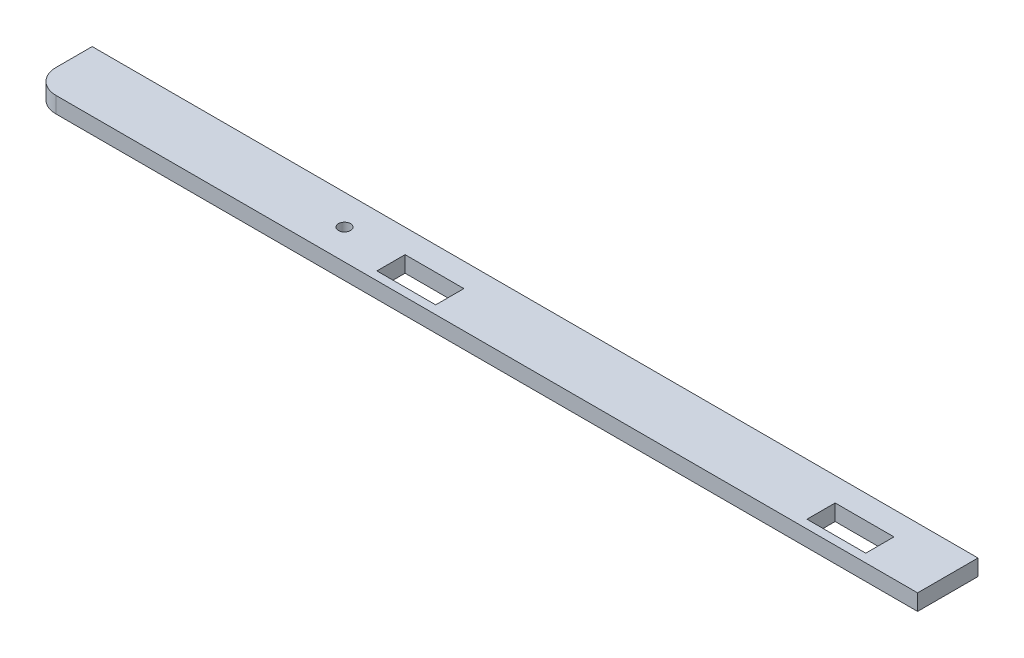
SolidWorks part; units mm, degrees
ref_plane "Front" through (0, 0, 0) normal (0, 0, 1) x (1, 0, 0)
ref_plane "Top" through (0, 0, 0) normal (0, 1, 0) x (1, 0, 0)
ref_plane "Right" through (0, 0, 0) normal (1, 0, 0) x (0, 0, -1)
ref_plane "Plane1" through (0, 3, 0) normal (0, 1, 0) x (1, 0, 0)
sketch "Sketch1" plane through (0, 3, 0) normal (0, 1, 0) x (1, 0, 0)
  line L0 (-141, -121) -> (78.9707, -121)
  line L1 (78.9707, -121) -> (78.9707, -106)
  line L2 (78.9707, -106) -> (-141, -106)
  line L3 (-141, -106) -> (-141, -121)
  circle A0 centre (-70.85, -113.5) radius 1.5
  dimension "D7" = 3
  dimension "D2" = 106
  dimension "D3" = 121
  dimension "D5" = 7.5
extrude "Boss-Extrude1" add sketch "Sketch1" against normal blind 4
sketch "Sketch4" plane through (0, 3, 0) normal (0, 1, 0) x (-1, 0, 0)
  line L0 (-57.4019, 113.9) -> (-53.4, 113.9)
  line L1 (-53.4, 116.9) -> (-57.4019, 116.9)
  line L3 (-49.4, 111.9) -> (-64, 111.9)
  line L4 (-49.4, 111.9) -> (-49.4, 118.9)
  line L5 (-49.4, 118.9) -> (-64, 118.9)
  line L6 (-64, 111.9) -> (-64, 118.9)
  arc A0 (-57.4019, 116.9) -> (-57.4019, 113.9) centre (-60, 115.4) cw
  arc A1 (-53.4, 113.9) -> (-53.4, 116.9) centre (-53.4, 115.4) ccw
  dimension "D1" = 2
  dimension "D2" = 2
  dimension "D3" = 4
  dimension "D4" = 4
extrude "Cut-Extrude3" cut sketch "Sketch4" against normal through all
sketch "Sketch5" plane through (0, -1, 0) normal (0, -1, 0) x (1, 0, 0)
  line L0 (-53.4, 113.9) -> (-49.3981, 113.9)
  line L1 (-49.3981, 116.9) -> (-53.4, 116.9)
  line L3 (-57.4, 111.9) -> (-42.8, 111.9)
  line L4 (-57.4, 111.9) -> (-57.4, 118.9)
  line L5 (-57.4, 118.9) -> (-42.8, 118.9)
  line L6 (-42.8, 111.9) -> (-42.8, 118.9)
  arc A0 (-53.4, 116.9) -> (-53.4, 113.9) centre (-53.4, 115.4) ccw
  arc A1 (-49.3981, 113.9) -> (-49.3981, 116.9) centre (-46.8, 115.4) cw
  dimension "D1" = 4
  dimension "D4" = 4
  dimension "D2" = 2
  dimension "D3" = 2
extrude "Cut-Extrude4" cut sketch "Sketch5" against normal through all
fillet "Fillet1" radius 6 1 edges at (-141, 1, 121)
